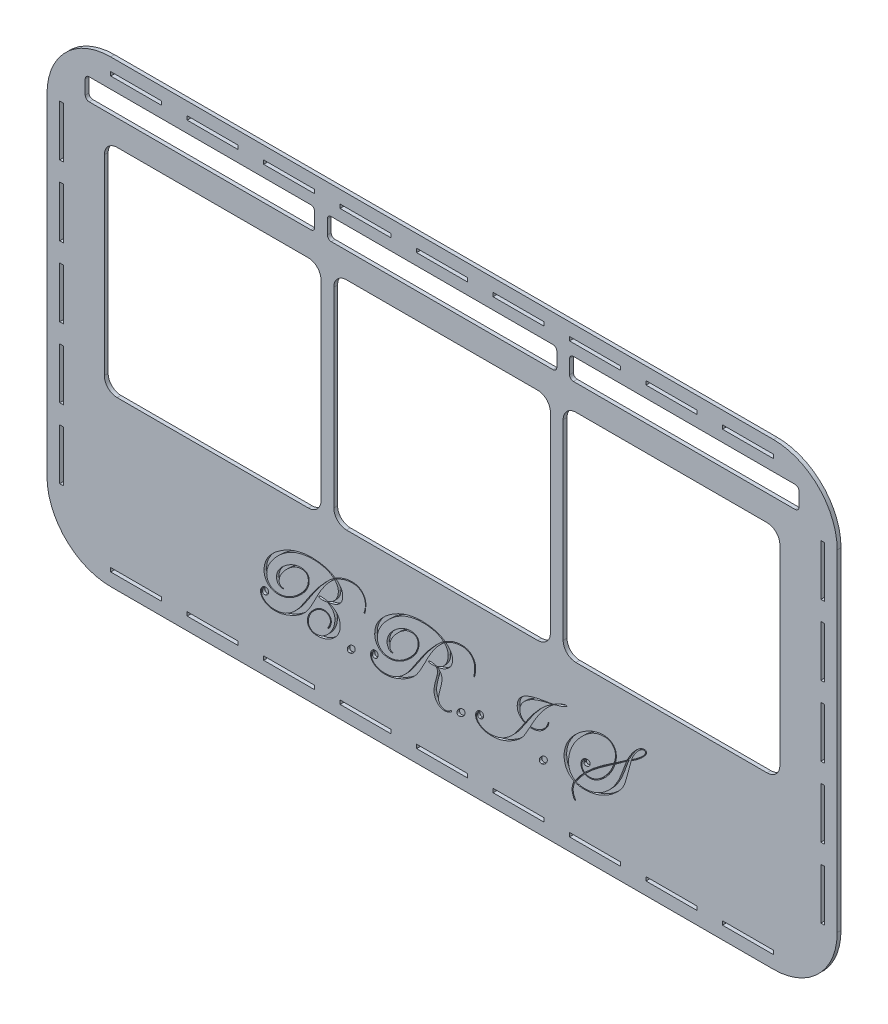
SolidWorks part; units mm, degrees
ref_plane "Front Plane" through (0, 0, 0) normal (0, 0, 1) x (1, 0, 0)
ref_plane "Top Plane" through (0, 0, 0) normal (0, 1, 0) x (1, 0, 0)
ref_plane "Right Plane" through (0, 0, 0) normal (1, 0, 0) x (0, 0, -1)
sketch "Sketch1" plane through (0, 0, 0) normal (0, 0, 1) x (1, 0, 0)
  line L1 (260, -180) -> (-260, -180)
  line L2 (310, -130) -> (310, 130)
  line L3 (260, 180) -> (-260, 180)
  line L4 (-310, -130) -> (-310, 130)
  line L5 (310, -180) -> (-310, 180) construction
  line L6 (310, 180) -> (-310, -180) construction
  arc A0 (310, 130) -> (260, 180) centre (260, 130) ccw
  arc A1 (260, -180) -> (310, -130) centre (260, -130) ccw
  arc A2 (-260, -180) -> (-310, -130) centre (-260, -130) cw
  arc A3 (-260, 180) -> (-310, 130) centre (-260, 130) ccw
  point P0 (0, 0)
  dimension "D3" = 50
  dimension "D1" = 620
  dimension "D2" = 360
extrude "Boss-Extrude1" add sketch "Sketch1" along normal blind 3
sketch "Sketch2" plane through (0, 0, 3) normal (0, 0, 1) x (1, 0, 0)
  line L0 (0, 180) -> (0, -49) construction
  line L1 (75, -49) -> (1.8507, -49)
  line L2 (85, -39) -> (85, 111)
  line L3 (75, 121) -> (-75, 121)
  line L4 (-85, -39) -> (-85, 111)
  line L5 (85, -49) -> (-85, 121) construction
  line L6 (85, 121) -> (-85, -49) construction
  line L7 (260, 180) -> (-260, 180) construction
  line L9 (105, 121) -> (255, 121)
  line L10 (-105, -49) -> (-255, -49)
  line L11 (-95, -39) -> (-95, 111)
  line L12 (-105, 121) -> (-255, 121)
  line L13 (-265, -39) -> (-265, 111)
  line L14 (-95, -49) -> (-265, 121) construction
  line L15 (-95, 121) -> (-265, -49) construction
  line L16 (265, -39) -> (265, 111)
  line L17 (105, -49) -> (255, -49)
  line L18 (95, -39) -> (95, 111)
  line L19 (103, 158) -> (277, 158)
  line L26 (-103, 141) -> (-277, 141)
  line L27 (-100, 144) -> (-100, 155)
  line L28 (-103, 158) -> (-277, 158)
  line L29 (-280, 144) -> (-280, 155)
  line L30 (-100, 141) -> (-280, 158) construction
  line L31 (-100, 158) -> (-280, 141) construction
  line L32 (87, 141) -> (-87, 141)
  line L33 (90, 144) -> (90, 155)
  line L34 (87, 158) -> (-87, 158)
  line L35 (-90, 144) -> (-90, 155)
  line L36 (90, 141) -> (-90, 158) construction
  line L37 (90, 158) -> (-90, 141) construction
  line L38 (280, 144) -> (280, 155)
  line L39 (103, 141) -> (277, 141)
  line L40 (100, 144) -> (100, 155)
  line L41 (-4.1493, -49) -> (1.8507, -49)
  line L42 (-4.1493, -49) -> (-75, -49)
  arc A4 (265, -39) -> (255, -49) centre (255, -39) cw
  arc A5 (255, 121) -> (265, 111) centre (255, 111) cw
  arc A6 (105, 121) -> (95, 111) centre (105, 111) ccw
  arc A7 (105, -49) -> (95, -39) centre (105, -39) cw
  arc A8 (-75, -49) -> (-85, -39) centre (-75, -39) cw
  arc A9 (75, -49) -> (85, -39) centre (75, -39) ccw
  arc A10 (85, 111) -> (75, 121) centre (75, 111) ccw
  arc A11 (-75, 121) -> (-85, 111) centre (-75, 111) ccw
  arc A12 (-95, 111) -> (-105, 121) centre (-105, 111) ccw
  arc A13 (-105, -49) -> (-95, -39) centre (-105, -39) ccw
  arc A14 (-255, -49) -> (-265, -39) centre (-255, -39) cw
  arc A15 (-255, 121) -> (-265, 111) centre (-255, 111) ccw
  arc A16 (280, 144) -> (277, 141) centre (277, 144) cw
  arc A17 (277, 158) -> (280, 155) centre (277, 155) cw
  arc A18 (103, 158) -> (100, 155) centre (103, 155) ccw
  arc A19 (103, 141) -> (100, 144) centre (103, 144) cw
  arc A20 (87, 141) -> (90, 144) centre (87, 144) ccw
  arc A21 (90, 155) -> (87, 158) centre (87, 155) ccw
  arc A22 (-87, 158) -> (-90, 155) centre (-87, 155) ccw
  arc A23 (-87, 141) -> (-90, 144) centre (-87, 144) cw
  arc A24 (-103, 141) -> (-100, 144) centre (-103, 144) ccw
  arc A25 (-100, 155) -> (-103, 158) centre (-103, 155) ccw
  arc A26 (-277, 158) -> (-280, 155) centre (-277, 155) ccw
  arc A27 (-277, 141) -> (-280, 144) centre (-277, 144) cw
  point P0 (0, 36)
  point P13 (-180, 36)
  point P22 (0, -109)
  point P40 (265, -49)
  point P43 (265, 121)
  point P46 (95, 121)
  point P49 (95, -49)
  point P74 (-190, 149.5)
  point P80 (0, 149.5)
  point P94 (280, 141)
  point P97 (280, 158)
  point P100 (100, 158)
  point P103 (100, 141)
  dimension "D18" = 3
  dimension "D1" = 170
  dimension "D2" = 170
  dimension "D3" = 170
  dimension "D4" = 170
  dimension "D5" = 10
  dimension "D6" = 10
  dimension "D9" = 17
  dimension "D10" = 180
  dimension "D11" = 17
  dimension "D12" = 180
  dimension "D13" = 20
  dimension "D15" = 22
extrude "Cut-Extrude1" cut sketch "Sketch2" against normal blind 3
sketch "Sketch5" plane through (0, 0, 3) normal (0, 0, 1) x (1, 0, 0)
  line L0 (-310, 130) -> (-310, -130) construction
  line L1 (-300, 130) -> (-297.2, 130)
  line L2 (-300, 130) -> (-300, 90)
  line L3 (-300, 90) -> (-297.2, 90)
  line L4 (-297.2, 130) -> (-297.2, 90)
  line L5 (-300, 75) -> (-300, 35)
  line L6 (-300, 75) -> (-297.2, 75)
  line L7 (-297.2, 75) -> (-297.2, 35)
  line L8 (-300, 35) -> (-297.2, 35)
  line L9 (-300, 20) -> (-300, -20)
  line L10 (-300, 20) -> (-297.2, 20)
  line L11 (-297.2, 20) -> (-297.2, -20)
  line L12 (-300, -20) -> (-297.2, -20)
  line L13 (-300, -35) -> (-300, -75)
  line L14 (-300, -35) -> (-297.2, -35)
  line L15 (-297.2, -35) -> (-297.2, -75)
  line L16 (-300, -75) -> (-297.2, -75)
  line L17 (-300, -90) -> (-300, -130)
  line L18 (-300, -90) -> (-297.2, -90)
  line L19 (-297.2, -90) -> (-297.2, -130)
  line L20 (-300, -130) -> (-297.2, -130)
  line L21 (-260, -180) -> (260, -180) construction
  line L22 (-260, -170) -> (-220, -170)
  line L23 (-260, -170) -> (-260, -167)
  line L24 (-260, -167) -> (-220, -167)
  line L25 (-220, -170) -> (-220, -167)
  line L58 (-310, 0) -> (310, 0) construction
  line L59 (310, -130) -> (310, 130) construction
  line L60 (0, 180) -> (0, -180) construction
  line L61 (260, 180) -> (-260, 180) construction
  line L62 (300, -90) -> (297.2, -90)
  line L63 (297.2, -90) -> (297.2, -130)
  line L64 (300, -130) -> (297.2, -130)
  line L65 (300, -90) -> (300, -130)
  line L66 (300, -35) -> (297.2, -35)
  line L67 (297.2, -35) -> (297.2, -75)
  line L68 (300, -75) -> (297.2, -75)
  line L69 (300, -35) -> (300, -75)
  line L70 (300, 20) -> (297.2, 20)
  line L71 (297.2, 20) -> (297.2, -20)
  line L72 (300, -20) -> (297.2, -20)
  line L73 (300, 20) -> (300, -20)
  line L74 (300, 75) -> (297.2, 75)
  line L75 (297.2, 75) -> (297.2, 35)
  line L76 (300, 35) -> (297.2, 35)
  line L77 (300, 75) -> (300, 35)
  line L78 (300, 90) -> (297.2, 90)
  line L79 (297.2, 130) -> (297.2, 90)
  line L80 (300, 130) -> (297.2, 130)
  line L81 (300, 130) -> (300, 90)
  line L114 (-260, 167) -> (-220, 167)
  line L115 (-220, 170) -> (-220, 167)
  line L116 (-260, 170) -> (-220, 170)
  line L117 (-260, 170) -> (-260, 167)
  line L118 (-200, 167) -> (-160, 167)
  line L119 (-160, 170) -> (-160, 167)
  line L120 (-200, 170) -> (-160, 170)
  line L121 (-200, 170) -> (-200, 167)
  line L122 (-140, 167) -> (-100, 167)
  line L123 (-100, 170) -> (-100, 167)
  line L124 (-140, 170) -> (-100, 170)
  line L125 (-140, 170) -> (-140, 167)
  line L126 (-80, 167) -> (-40, 167)
  line L127 (-40, 170) -> (-40, 167)
  line L128 (-80, 170) -> (-40, 170)
  line L129 (-80, 170) -> (-80, 167)
  line L130 (-20, 167) -> (20, 167)
  line L131 (20, 170) -> (20, 167)
  line L132 (-20, 170) -> (20, 170)
  line L133 (-20, 170) -> (-20, 167)
  line L134 (40, 167) -> (80, 167)
  line L135 (80, 170) -> (80, 167)
  line L136 (40, 170) -> (80, 170)
  line L137 (40, 170) -> (40, 167)
  line L138 (100, 167) -> (140, 167)
  line L139 (140, 170) -> (140, 167)
  line L140 (100, 170) -> (140, 170)
  line L141 (100, 170) -> (100, 167)
  line L142 (160, 167) -> (200, 167)
  line L143 (200, 170) -> (200, 167)
  line L144 (160, 170) -> (200, 170)
  line L145 (160, 170) -> (160, 167)
  line L146 (220, 167) -> (260, 167)
  line L147 (260, 170) -> (260, 167)
  line L148 (220, 170) -> (260, 170)
  line L149 (220, 170) -> (220, 167)
  line L150 (-200, -170) -> (-200, -167)
  line L151 (-200, -170) -> (-160, -170)
  line L152 (-160, -170) -> (-160, -167)
  line L153 (-200, -167) -> (-160, -167)
  line L154 (-140, -170) -> (-140, -167)
  line L155 (-140, -170) -> (-100, -170)
  line L156 (-100, -170) -> (-100, -167)
  line L157 (-140, -167) -> (-100, -167)
  line L158 (-80, -170) -> (-80, -167)
  line L159 (-80, -170) -> (-40, -170)
  line L160 (-40, -170) -> (-40, -167)
  line L161 (-80, -167) -> (-40, -167)
  line L162 (-20, -170) -> (-20, -167)
  line L163 (-20, -170) -> (20, -170)
  line L164 (20, -170) -> (20, -167)
  line L165 (-20, -167) -> (20, -167)
  line L166 (40, -170) -> (40, -167)
  line L167 (40, -170) -> (80, -170)
  line L168 (80, -170) -> (80, -167)
  line L169 (40, -167) -> (80, -167)
  line L170 (100, -170) -> (100, -167)
  line L171 (100, -170) -> (140, -170)
  line L172 (140, -170) -> (140, -167)
  line L173 (100, -167) -> (140, -167)
  line L174 (160, -170) -> (160, -167)
  line L175 (160, -170) -> (200, -170)
  line L176 (200, -170) -> (200, -167)
  line L177 (160, -167) -> (200, -167)
  line L178 (220, -170) -> (220, -167)
  line L179 (220, -170) -> (260, -170)
  line L180 (260, -170) -> (260, -167)
  line L181 (220, -167) -> (260, -167)
  dimension "D1" = 2.8
  dimension "D2" = 40
  dimension "D3" = 10
  dimension "D4" = 0
  dimension "D6" = 10
  dimension "D7" = 40
  dimension "D8" = 3
  dimension "D9" = 0
  dimension "D11" = 9
  dimension "D5" = 5
  dimension "D10" = 9
extrude "Cut-Extrude4" cut sketch "Sketch5" against normal blind 3
sketch "Sketch6" plane through (0, 0, 3) normal (0, 0, 1) x (1, 0, 0)
  text T0 "B.R.I.S" font "Edwardian Script ITC" height 50
extrude "Cut-Extrude5" cut sketch "Sketch6" against normal blind 2
